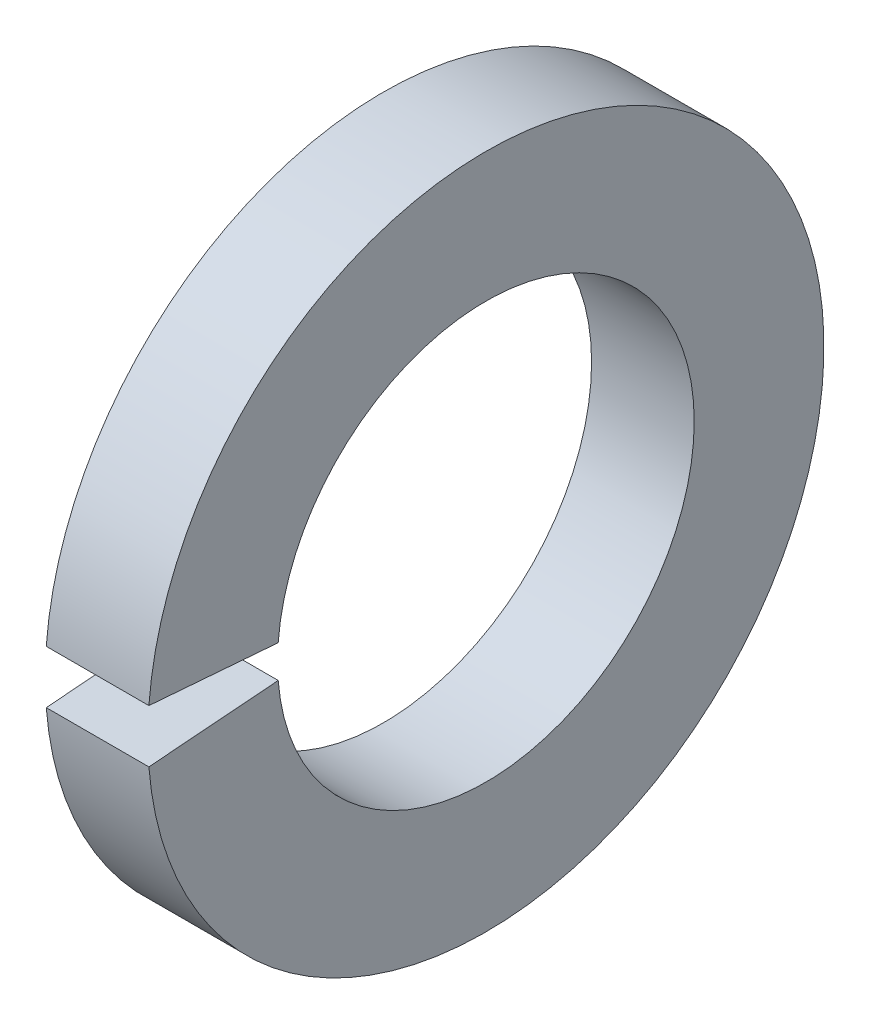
SolidWorks part; units mm, degrees
ref_plane "Plane1" through (0, 0, 0) normal (0, 0, 1) x (1, 0, 0)
ref_plane "Plane2" through (0, 0, 0) normal (0, 1, 0) x (1, 0, 0)
ref_plane "Plane3" through (0, 0, 0) normal (1, 0, 0) x (0, 0, -1)
sketch "Sketch1" plane through (0, 0, 0) normal (0, 0, 1) x (1, 0, 0)
  line L0 (-34.925, 0) -> (9.525, 0) construction
  line L1 (0, 12.8905) -> (0, 20.9169)
  line L2 (0, 20.9169) -> (-6.35, 20.9169)
  line L3 (-6.35, 20.9169) -> (-6.35, 12.8905)
  line L4 (-6.35, 12.8905) -> (0, 12.8905)
  dimension "Thickness" = 6.35
  dimension "Inside_dia" = 25.781
  dimension "Outside_dia" = 41.8338
revolve "Base-Revolve" add sketch "Sketch1" angle 360 about L0
sketch "Sketch2" plane through (0, 0, 0) normal (-1, 0, 0) x (0, -1, 0)
  line L0 (0, 0) -> (1.6739, 21.2695)
  line L1 (0, -3.175) -> (0, 12.7) construction
  line L2 (0, 0) -> (-1.6739, 21.2695)
  arc A0 (1.6739, 21.2695) -> (-1.6739, 21.2695) centre (0, 0) ccw
  dimension "D1" = 21.3352
  dimension "Gap_ang" = 9
extrude "Gap" cut sketch "Sketch2" along normal through all
equation "\"D1@Sketch2\" = \"Outside_dia@Sketch1\" * 0.51"
